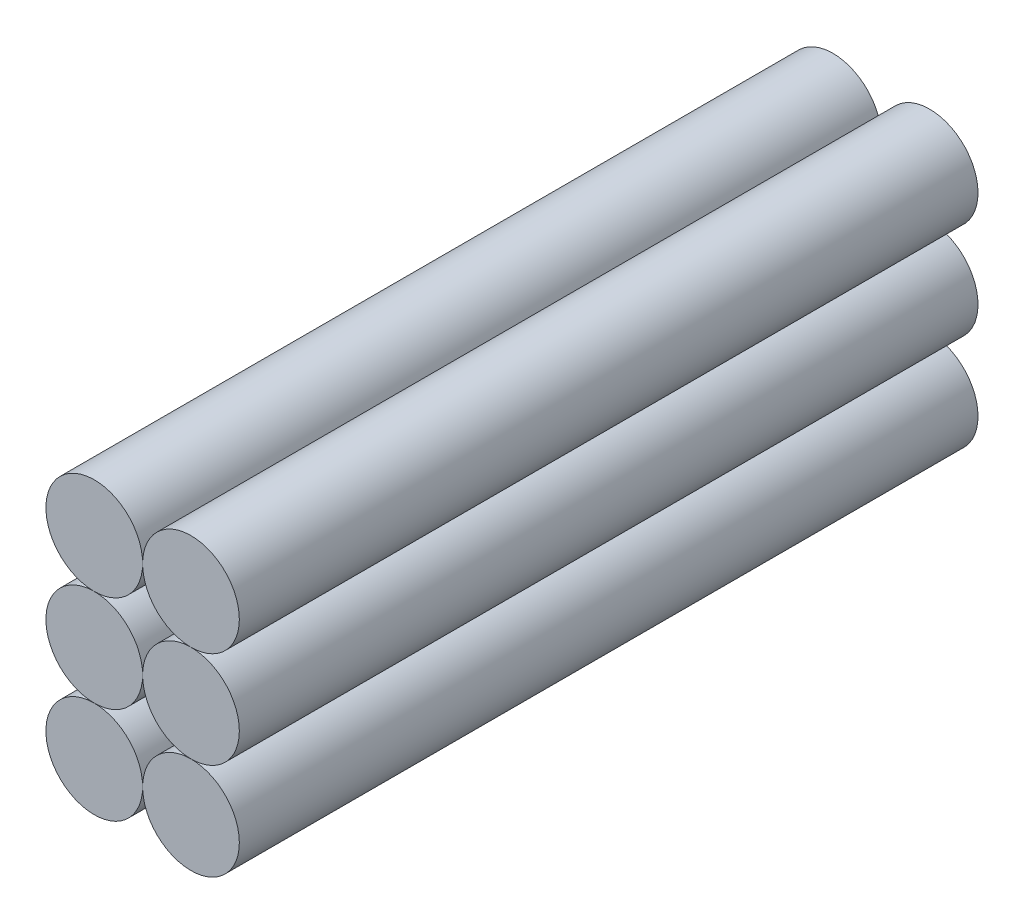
SolidWorks part; units mm, degrees
ref_plane "Front" through (0, 0, 0) normal (0, 0, 1) x (1, 0, 0)
ref_plane "Top" through (0, 0, 0) normal (0, 1, 0) x (1, 0, 0)
ref_plane "Right" through (0, 0, 0) normal (1, 0, 0) x (0, 0, -1)
sketch "Sketch1" plane through (0, 0, 0) normal (0, 0, 1) x (1, 0, 0)
  line L0 (-8.9789, 0) -> (8.9789, 0) construction
  line L1 (-8.9789, 0) -> (-8.9789, 17.9578) construction
  line L2 (-8.9789, 0) -> (-8.9789, -17.9578) construction
  line L4 (8.9789, 0) -> (8.9789, 17.9578) construction
  line L5 (8.9789, 0) -> (8.9789, -17.9578) construction
  line L6 (-8.9789, 17.9578) -> (8.9789, 17.9578) construction
  line L7 (8.9789, -17.9578) -> (-8.9789, -17.9578) construction
  circle A0 centre (-8.9789, 0) radius 8.9789
  circle A1 centre (-8.9789, 17.9578) radius 8.9789
  circle A2 centre (8.9789, 17.9578) radius 8.9789
  circle A3 centre (8.9789, 0) radius 8.9789
  circle A4 centre (8.9789, -17.9578) radius 8.9789
  circle A5 centre (-8.9789, -17.9578) radius 8.9789
  point P14 (-17.9578, 17.9578)
  point P15 (17.9578, 17.9578)
  dimension "D1" = 35.9156
extrude "Boss-Extrude1" add sketch "Sketch1" along normal mid plane 137.16 contours A1 | A2 | A3 | A0 | A5 | A4
sketch "Sketch3" plane through (0, 0, 0) normal (0, 0, 1) x (1, 0, 0)
  circle A0 centre (0, 0) radius 20.8766 construction
  circle A1 centre (0, 0) radius 8.9789
  circle A2 centre (-19.4303, 7.6353) radius 8.9789
  circle A3 centre (-18.1711, -10.2783) radius 8.9789
  circle A4 centre (11.476, 17.4395) radius 8.9789
  circle A5 centre (20.7732, 2.0757) radius 8.9789
  circle A6 centre (-6.3125, 19.8994) radius 8.9789
  circle A7 centre (-3.4668, -20.5868) radius 8.9789
  circle A8 centre (14.6999, -14.8239) radius 8.9789
  dimension "D1" = 17.9578
extrude "Boss-Extrude2" [suppressed] add sketch "Sketch3" along normal mid plane 137.16 separate body
